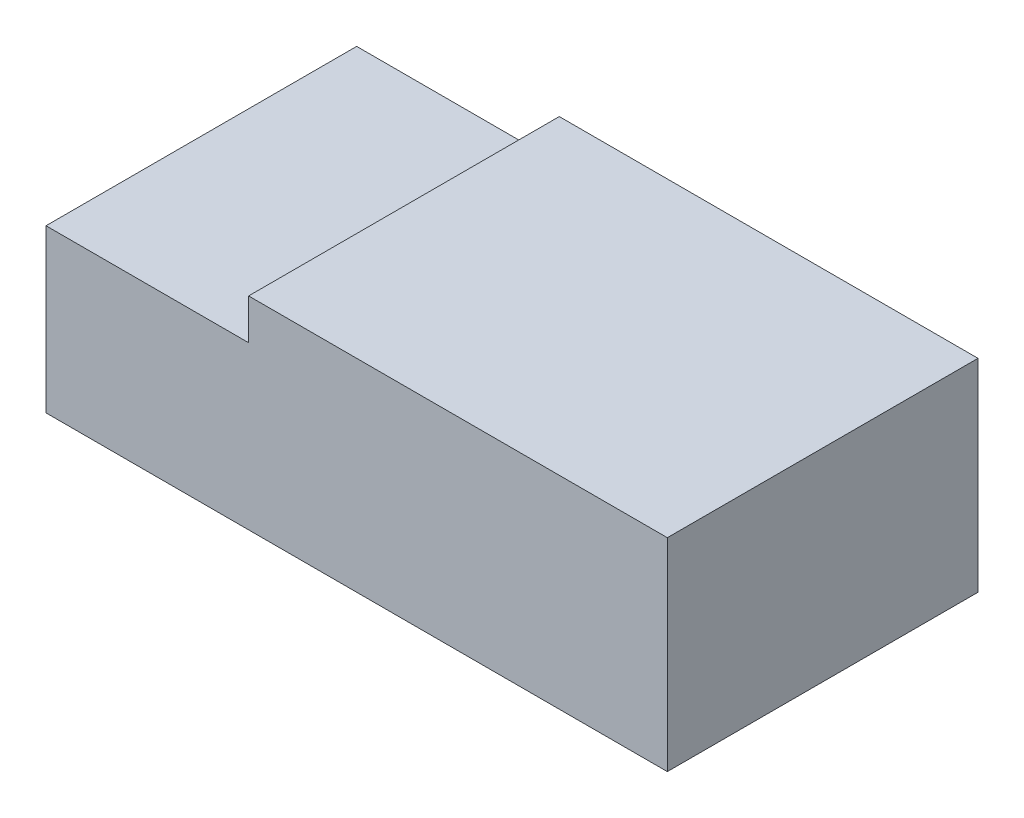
SolidWorks part; units mm, degrees
ref_plane "Front Plane" through (0, 0, 0) normal (0, 0, 1) x (1, 0, 0)
ref_plane "Top Plane" through (0, 0, 0) normal (0, 1, 0) x (1, 0, 0)
ref_plane "Right Plane" through (0, 0, 0) normal (1, 0, 0) x (0, 0, -1)
sketch "Sketch1" plane through (0, 0, 0) normal (0, 1, 0) x (1, 0, 0)
  line L1 (-115, 57.5) -> (115, 57.5)
  line L2 (-115, 57.5) -> (-115, -57.5)
  line L3 (-115, -57.5) -> (115, -57.5)
  line L4 (115, 57.5) -> (115, -57.5)
  line L5 (-115, 57.5) -> (115, -57.5) construction
  line L6 (-115, -57.5) -> (115, 57.5) construction
  point P0 (0, 0)
  dimension "D1" = 230
  dimension "D2" = 115
extrude "Boss-Extrude1" add sketch "Sketch1" along normal mid plane 75
sketch "Sketch2" plane through (0, 37.5, 0) normal (0, 1, 0) x (1, 0, 0)
  line L0 (-115, -57.5) -> (115, -57.5) construction
  line L1 (-115, 57.5) -> (-40, 57.5)
  line L2 (-115, 57.5) -> (-115, -57.5)
  line L3 (-115, -57.5) -> (-40, -57.5)
  line L4 (-40, 57.5) -> (-40, -57.5)
  dimension "D1" = 75
extrude "Cut-Extrude1" cut sketch "Sketch2" against normal blind 15
